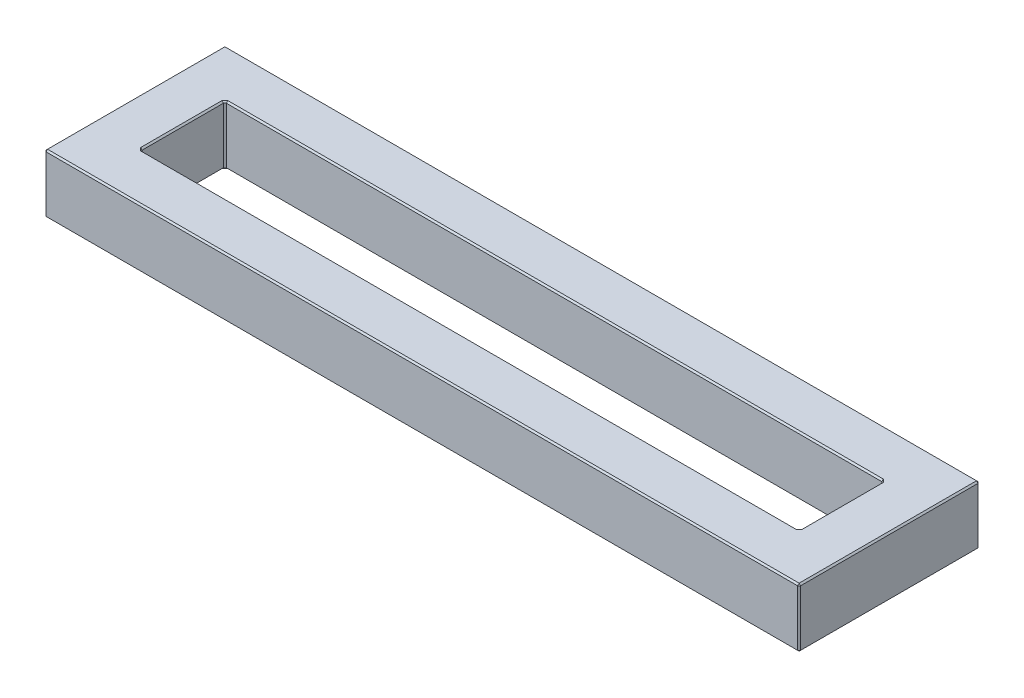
SolidWorks part; units mm, degrees
ref_plane "Front Plane" through (0, 0, 0) normal (0, 0, 1) x (1, 0, 0)
ref_plane "Top Plane" through (0, 0, 0) normal (0, 1, 0) x (1, 0, 0)
ref_plane "Right Plane" through (0, 0, 0) normal (1, 0, 0) x (0, 0, -1)
sketch "Sketch1" plane through (0, 0, 0) normal (0, 1, 0) x (1, 0, 0)
  line L1 (-62.75, 15) -> (62.75, 15)
  line L2 (-62.75, 15) -> (-62.75, -15)
  line L3 (-62.75, -15) -> (62.75, -15)
  line L4 (62.75, 15) -> (62.75, -15)
  line L5 (-62.75, 15) -> (62.75, -15) construction
  line L6 (-62.75, -15) -> (62.75, 15) construction
  line L7 (54.75, -7) -> (-54.75, -7)
  line L8 (54.75, -7) -> (54.75, 7)
  line L9 (54.75, 7) -> (-54.75, 7)
  line L10 (-54.75, -7) -> (-54.75, 7)
  line L11 (54.75, -7) -> (-54.75, 7) construction
  line L12 (54.75, 7) -> (-54.75, -7) construction
  point P0 (0, 0)
  point P5 (0, 0)
  point P11 (0, 0)
  dimension "D1" = 30
  dimension "D2" = 125.5
  dimension "D3" = 8
  dimension "D4" = 8
extrude "Boss-Extrude1" add sketch "Sketch1" along normal blind 9.8 contours L4 L1 L2 L3 L7 L10 L9 L8
chamfer "Chamfer1" distance 0.25 angle 45 24 edges at (54.75, 4.9, 7) (0, 0, 7) (-54.75, 4.9, 7) (-54.75, 0, 0) (-54.75, 4.9, -7) (-54.75, 9.8, 0) (0, 9.8, 7) (54.75, 0, 0) (0, 0, -7) (54.75, 9.8, 0) (0, 9.8, -7) (54.75, 4.9, -7) (0, 0, -15) (62.75, 4.9, -15) (62.75, 0, 0) (62.75, 4.9, 15) (62.75, 9.8, 0) (0, 0, 15) (0, 9.8, 15) (-62.75, 0, 0) (0, 9.8, -15) (-62.75, 4.9, -15) (-62.75, 9.8, 0) (-62.75, 4.9, 15)
